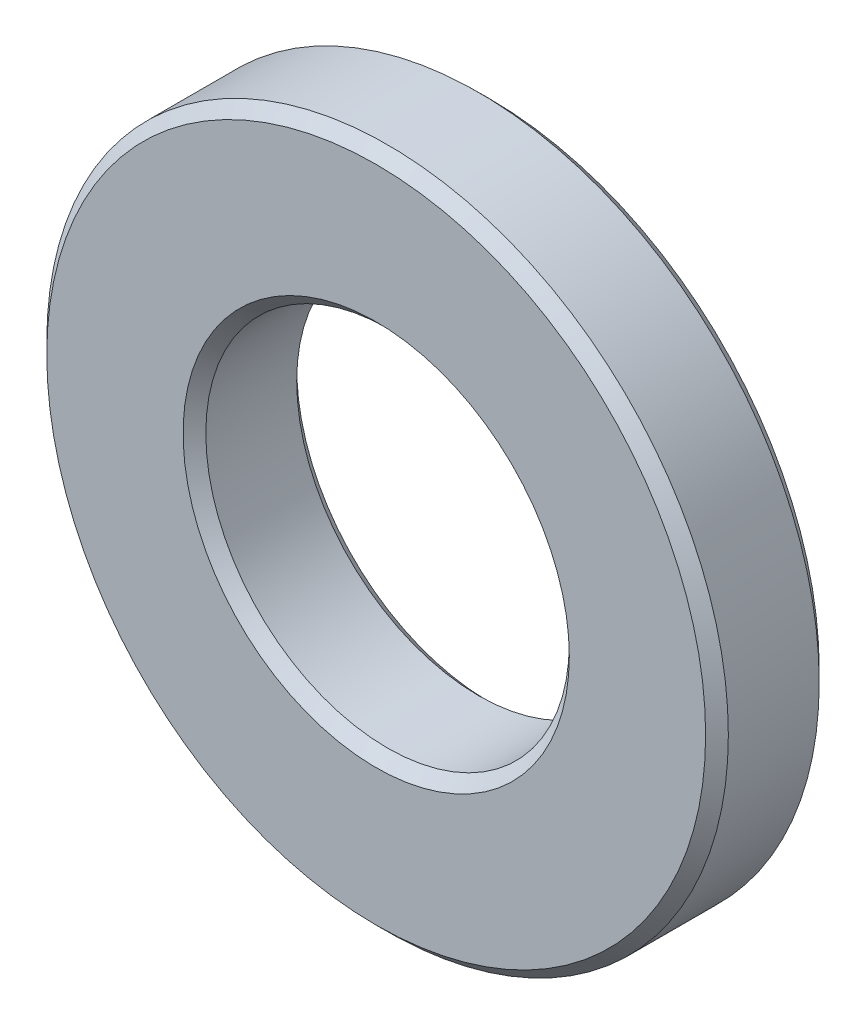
SolidWorks part; units mm, degrees
ref_plane "Front Plane" through (0, 0, 0) normal (0, 0, 1) x (1, 0, 0)
ref_plane "Top Plane" through (0, 0, 0) normal (0, 1, 0) x (1, 0, 0)
ref_plane "Right Plane" through (0, 0, 0) normal (1, 0, 0) x (0, 0, -1)
sketch "Sketch1" plane through (0, 0, 0) normal (0, 0, 1) x (1, 0, 0)
  circle A0 centre (0, 0) radius 3
  circle A1 centre (0, 0) radius 1.6
  dimension "D1" = 6
  dimension "D2" = 3.2
extrude "Boss-Extrude2" add sketch "Sketch1" along normal mid plane 1
chamfer "Chamfer3" distance 0.1 angle 45 4 edges at (3, 0, 0.5) (3, 0, -0.5) (1.6, 0, -0.5) (1.6, 0, 0.5)
